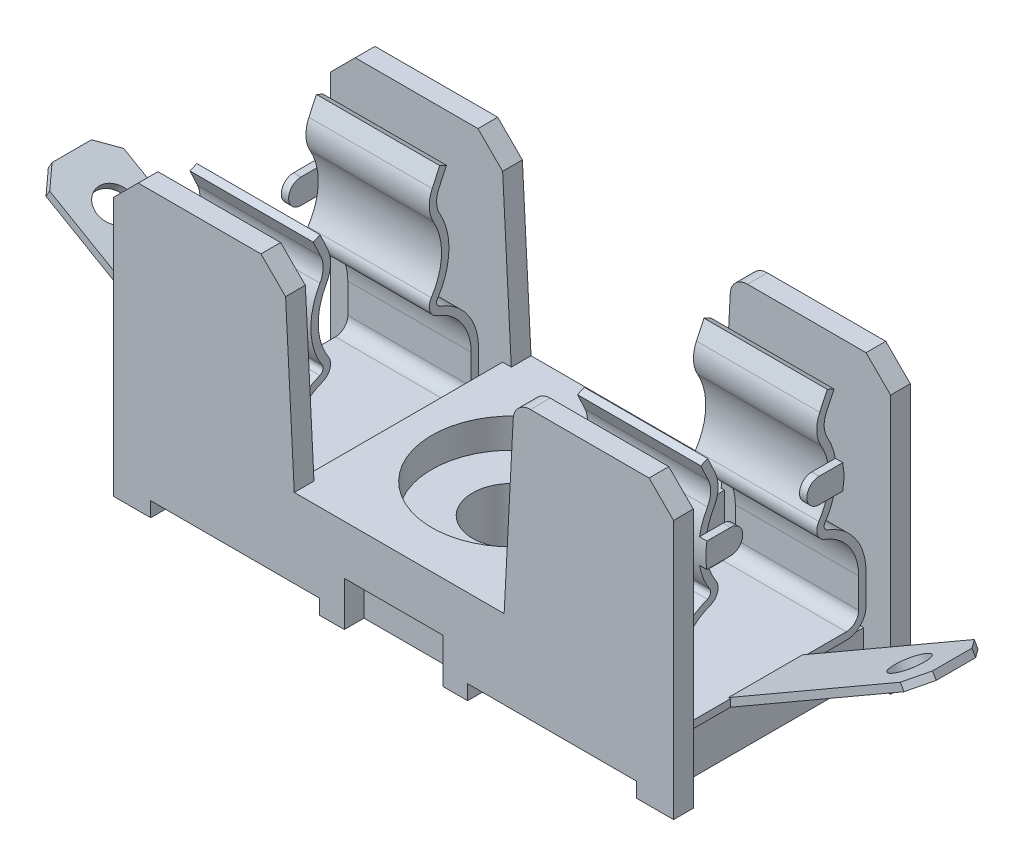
SolidWorks part; units mm, degrees
ref_plane "Front" through (0, 0, 0) normal (0, 0, 1) x (1, 0, 0)
ref_plane "Top" through (0, 0, 0) normal (0, 1, 0) x (1, 0, 0)
ref_plane "Right" through (0, 0, 0) normal (1, 0, 0) x (0, 0, -1)
imported_body "Импортированный1"
sketch "Эскиз1" plane through (10.356, 0, 0) normal (1, 0, 0) x (0, 0, -1)
  line L1 (-4, 2.3) -> (4, 2.3)
  line L2 (-4, 2.3) -> (-4, 0.5)
  line L3 (-4, 0.5) -> (4, 0.5)
  line L4 (4, 2.3) -> (4, 0.5)
extrude "Вытянуть1" cut sketch "Эскиз1" against normal blind 0.1
sketch "Эскиз2" plane through (-10.356, 0, 0) normal (-1, 0, 0) x (0, 0, 1)
  line L1 (-4, 2.3) -> (4, 2.3)
  line L2 (-4, 2.3) -> (-4, 0.5)
  line L3 (-4, 0.5) -> (4, 0.5)
  line L4 (4, 2.3) -> (4, 0.5)
extrude "Вытянуть2" cut sketch "Эскиз2" against normal blind 0.1
sketch "Эскиз3" plane through (0, 0, 0) normal (0, 0, 1) x (1, 0, 0)
  line L1 (5.55, 0) -> (11.35, 0)
  line L2 (5.55, 0) -> (5.55, 0.3)
  line L3 (5.55, 0.3) -> (10.356, 0.3)
  line L4 (11.35, 2) -> (11.35, 0.6) construction
  line L5 (10.356, 2.3) -> (10.356, 2.6) construction
  line L6 (11.35, 0) -> (11.35, 2.6)
  line L7 (11.35, 2.6) -> (10.356, 2.6)
  line L8 (10.356, 0.3) -> (10.356, 2.6)
  line L9 (10.356, 2.6) -> (10.75, 2.6) construction
  line L11 (5.55, 0.3) -> (10.356, 0.3) construction
extrude "Вытянуть4" cut sketch "Эскиз3" along normal mid plane 5.1
sketch "Эскиз4" plane through (0, 0, 0) normal (0, 0, 1) x (1, 0, 0)
  line L0 (-18, 6.7133) -> (-10.356, 2.3)
  line L1 (-18, 6.7133) -> (-17.85, 6.9731)
  line L2 (-10.356, 2.3) -> (-10.206, 2.5598)
  line L3 (-17.85, 6.9731) -> (-10.206, 2.5598)
  line L4 (-11.35, 0.5) -> (-9.85, 0.5) construction
  line L5 (0, 0) -> (0, 5.3824) construction
  line L6 (17.85, 6.9731) -> (10.206, 2.5598)
  line L7 (10.356, 2.3) -> (10.206, 2.5598)
  line L8 (18, 6.7133) -> (17.85, 6.9731)
  line L9 (18, 6.7133) -> (10.356, 2.3)
  dimension "D1" = 0.3
  dimension "D2" = 30
  dimension "D3" = 36
extrude "Вытянуть5" add sketch "Эскиз4" along normal mid plane 3
sketch "Эскиз5" plane through (-1.4431, -2.4995, 0) normal (0.5, 0.866, 0) x (0.866, -0.5, 0)
  line L0 (-18.9451, 0) -> (-16.9451, 0) construction
  line L1 (-18.9451, -1.5) -> (-18.9451, 1.5) construction
  circle A0 centre (-16.9451, 0) radius 0.7
  dimension "D1" = 2
  dimension "D2" = 1.4
extrude "Вытянуть6" cut sketch "Эскиз5" against normal through all
sketch "Эскиз6" plane through (1.4431, -2.4995, 0) normal (-0.5, 0.866, 0) x (0.866, 0.5, 0)
  line L0 (18.9451, -1.5) -> (18.9451, 1.5) construction
  line L1 (16.9451, 0) -> (18.9451, 0) construction
  circle A0 centre (16.9451, 0) radius 0.7
  dimension "D1" = 1.4
  dimension "D2" = 2
extrude "Вытянуть7" cut sketch "Эскиз6" against normal through all
chamfer "Фаска1" distance 0.7 angle 45 4 edges at (17.925, 6.8432, -1.5) (17.925, 6.8432, 1.5) (-17.925, 6.8432, -1.5) (-17.925, 6.8432, 1.5)
sketch "Эскиз7" plane through (0, 2.3, 0) normal (0, 1, 0) x (1, 0, 0)
  line L0 (4.3764, -4.8) -> (4.85, -4.8) construction
  line L1 (-4.3795, 4.8) -> (4.6132, 4.8)
  line L2 (-4.3795, 4.8) -> (-4.3795, -4.8)
  line L3 (-4.3795, -4.8) -> (4.6132, -4.8)
  line L4 (4.6132, 4.8) -> (4.6132, -4.8)
extrude "Вытянуть8" add sketch "Эскиз7" along normal blind 2
sketch "Эскиз8" plane through (0, 0, 0) normal (0, 0, 1) x (1, 0, 0)
  line L0 (0, 0) -> (0, 4.3) construction
  line L1 (-4.0284, 4.3) -> (4.4812, 4.3) construction
  line L2 (0, 4.3) -> (3.25, 4.3)
  line L3 (3.25, 4.3) -> (3.25, 3.1)
  line L4 (3.25, 3.1) -> (1.6, 3.1)
  line L5 (1.6, 3.1) -> (1.6, 0.5)
  line L6 (2, 0.5) -> (-2, 0.5) construction
  line L7 (1.6, 0.5) -> (0, 0.5)
  line L8 (0, 4.3) -> (0, 0.5)
  dimension "D1" = 3.2
  dimension "D2" = 6.5
  dimension "D3" = 1.2
revolve "Вырез-Повернуть1" cut sketch "Эскиз8" angle 360 about L0
